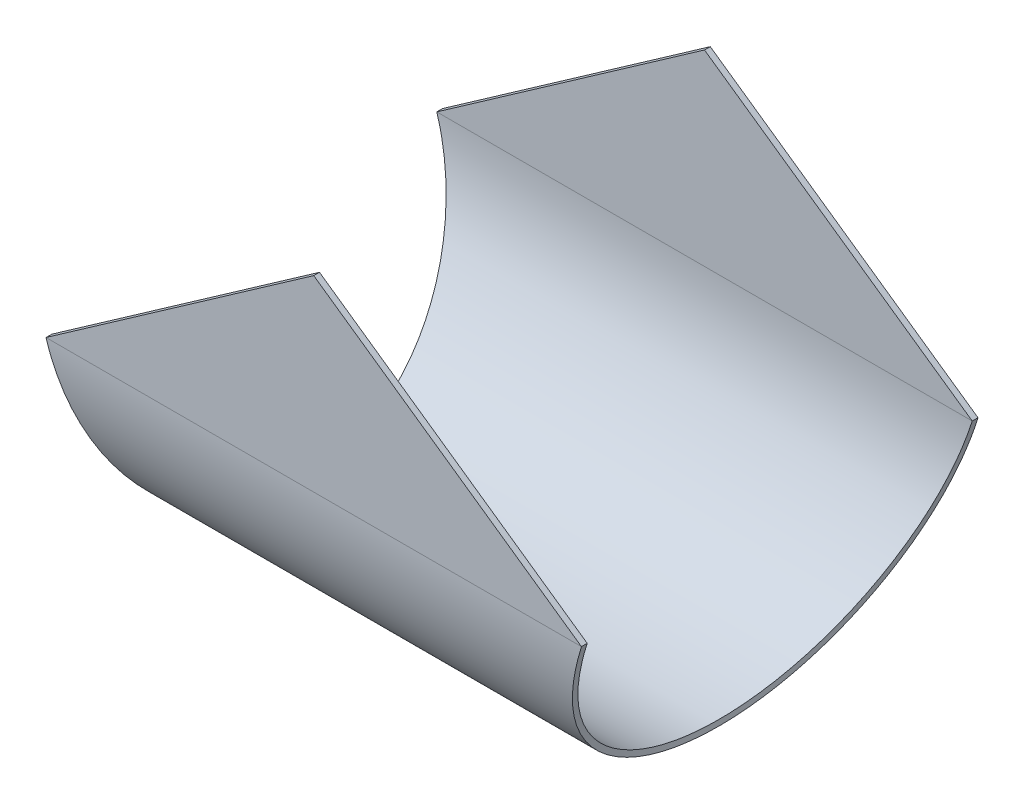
SolidWorks part; units mm, degrees
ref_plane "前视基准面" through (0, 0, 0) normal (0, 0, 1) x (1, 0, 0)
ref_plane "上视基准面" through (0, 0, 0) normal (0, 1, 0) x (1, 0, 0)
ref_plane "右视基准面" through (0, 0, 0) normal (1, 0, 0) x (0, 0, -1)
imported_body "基体零件-Y形补料管-1"
sheet metal parameters "钣金1" parameters "D1"=0.7366, "厚度"=8
bend "圆角折弯1" bend radius 267 bend angle 180 parameters "D5"=1
flatten bends "展开-折弯1"
sketch "尖角-草图1" plane through (0, 0, 267) normal (0, 0, -1) x (-1, 0, 0)
  line L0 (-371.3185, -679.4026) -> (371.3185, -679.4026) construction
  dimension "D1" = 0
process bends "加工-折弯1" parameters "D1"=0
sketch "平面-草图1" plane through (0, 0, 267) normal (0, 0, -1) x (-1, 0, 0)
flat pattern "平板型式1"
sketch "折弯-线1" plane through (0, 0, 0) normal (0, 1, 0) x (-1, 0, 0)
bend of the flat pattern "展开-<圆角折弯1>1"
